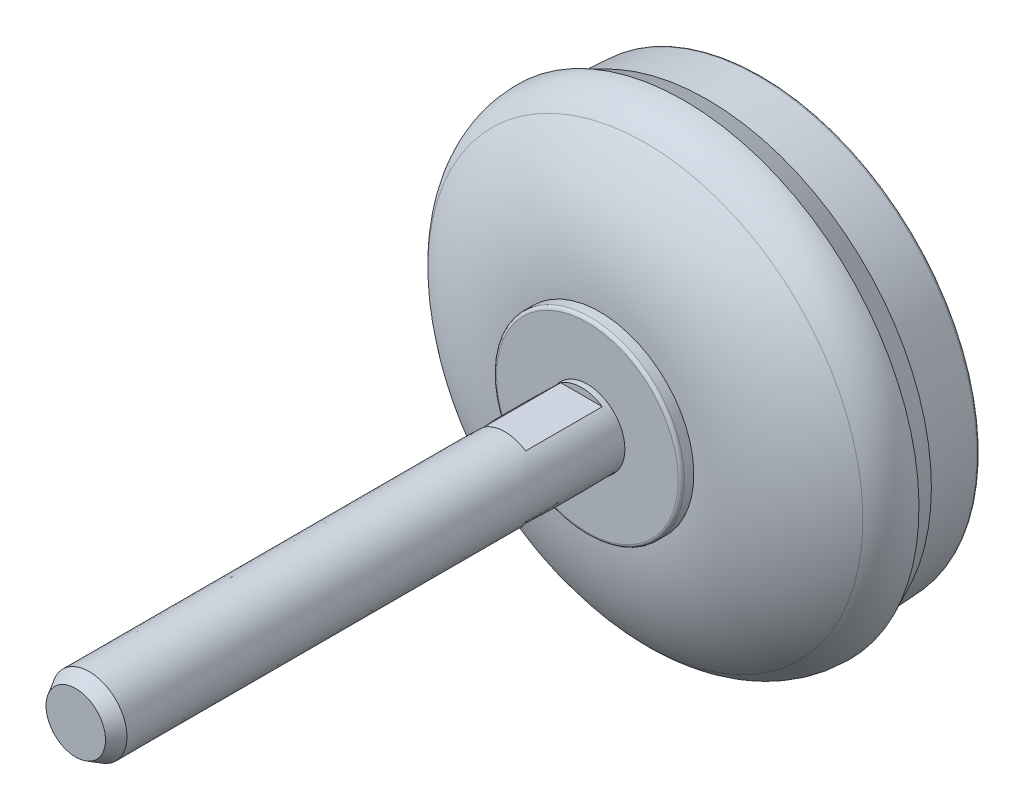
SolidWorks part; units mm, degrees
ref_plane "Alzado" through (0, 0, 0) normal (0, 0, 1) x (1, 0, 0)
ref_plane "Planta" through (0, 0, 0) normal (0, 1, 0) x (1, 0, 0)
ref_plane "Vista lateral" through (0, 0, 0) normal (1, 0, 0) x (0, 0, -1)
imported_body "Sólido importado1"
imported_body "Sólido importado2"
imported_body "Sólido importado3"
imported_body "Sólido importado4"
sketch "Croquis1" plane through (0, 0, 0) normal (1, 0, 0) x (0, 0, -1)
  line L0 (-108.9987, 228.506) -> (-26.8305, 228.506) construction
  line L1 (-108.9987, 223.756) -> (-108.9987, 233.256) construction
  line L2 (-26.8305, 213.506) -> (-26.8305, 243.506) construction
  line L3 (-35.9137, 223.506) -> (-35.9137, 233.506) construction
  line L4 (-28.2579, 233.506) -> (-40.498, 233.506)
  line L5 (-40.498, 233.506) -> (-40.498, 236.1228)
  line L6 (-40.498, 236.1228) -> (-28.2579, 236.1228)
  line L7 (-28.2579, 236.1228) -> (-28.2579, 233.506)
  line L8 (-40.498, 220.8892) -> (-28.2579, 220.8892)
  line L9 (-40.498, 223.506) -> (-40.498, 220.8892)
  line L10 (-28.2579, 223.506) -> (-40.498, 223.506)
  line L11 (-28.2579, 220.8892) -> (-28.2579, 223.506)
  point P9 (-35.9137, 228.506)
  dimension "D1" = 10
extrude "Cortar-Extruir1" cut sketch "Croquis1" along normal through all both and the other way through all
